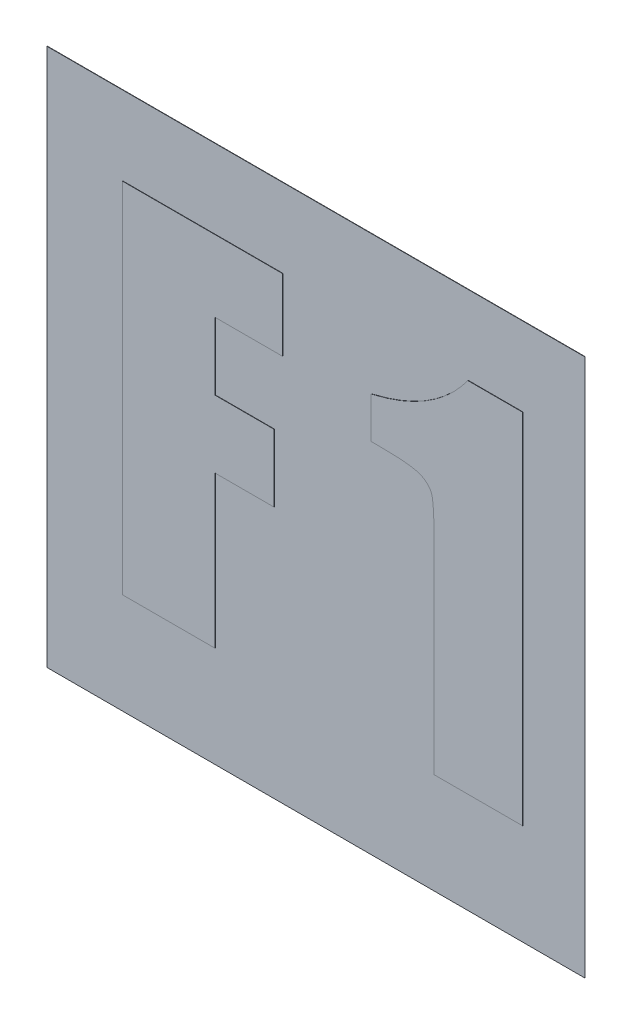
SolidWorks part; units mm, degrees
ref_plane "Plane1" through (0, 0, 0) normal (0, 0, 1) x (1, 0, 0)
ref_plane "Plane2" through (0, 0, 0) normal (0, 1, 0) x (1, 0, 0)
ref_plane "Plane3" through (0, 0, 0) normal (1, 0, 0) x (0, 0, -1)
sketch "Sketch1" plane through (0, 0, 0) normal (0, 0, 1) x (1, 0, 0)
  line L0 (-69.0098, 0) -> (69.0098, 0) construction
  line L1 (0, 52.3212) -> (0, -57.1323) construction
  line L2 (-7.5, 7.5) -> (7.5, 7.5)
  line L3 (-7.5, 7.5) -> (-7.5, -7.5)
  line L4 (7.5, 7.5) -> (7.5, -7.5)
  line L5 (-7.5, -7.5) -> (7.5, -7.5)
  point P8 (0, -7.5)
  point P11 (0, 7.5)
  point P12 (7.5, 0)
  point P13 (-7.5, 0)
  dimension "D1" = 15
  dimension "D2" = 15
extrude "Base-Extrude" add sketch "Sketch1" along normal blind 0.01
sketch "Sketch3" plane through (0, 0, 0.01) normal (0, 0, 1) x (1, 0, 0)
  text T0 "F 1" font "Impact" height in points 36
  point P1 (0, 0)
extrude "Boss-Extrude1" add sketch "Sketch3" along normal blind 0.01
